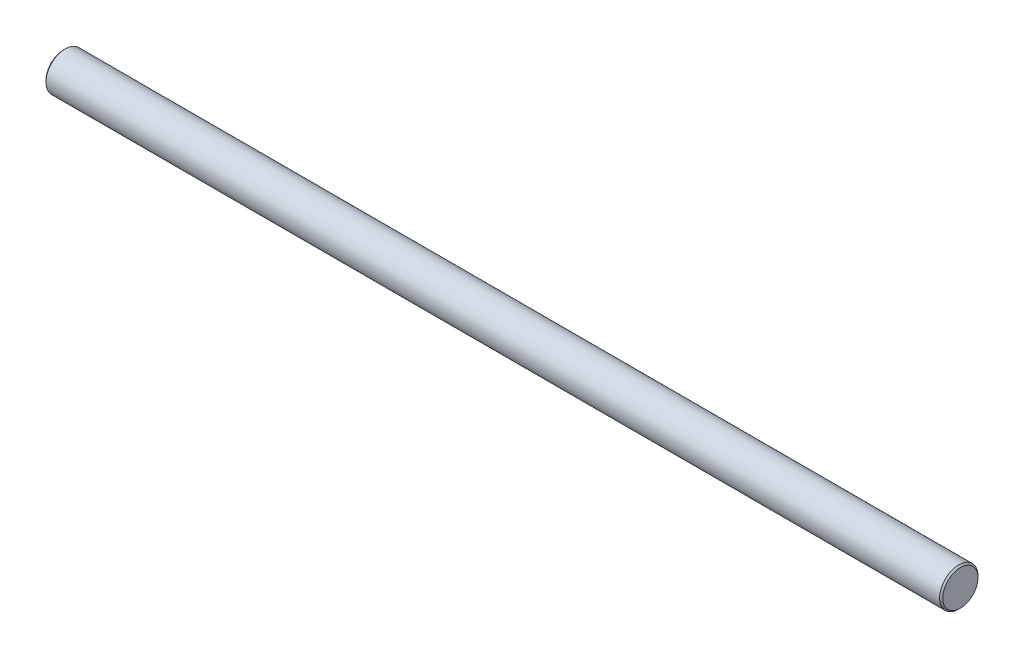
SolidWorks part; units mm, degrees
ref_plane "Спереди" through (0, 0, 0) normal (0, 0, 1) x (1, 0, 0)
ref_plane "Сверху" through (0, 0, 0) normal (0, 1, 0) x (1, 0, 0)
ref_plane "Справа" through (0, 0, 0) normal (1, 0, 0) x (0, 0, -1)
sketch "Эскиз1" plane through (0, 0, 0) normal (1, 0, 0) x (0, 0, -1)
  circle A0 centre (0, 0) radius 3
  dimension "D1" = 6
extrude "Бобышка-Вытянуть1" add sketch "Эскиз1" along normal blind 140
chamfer "Фаска1" distance 0.25 angle 45 2 edges at (0, 0, -3) (140, 0, -3)
